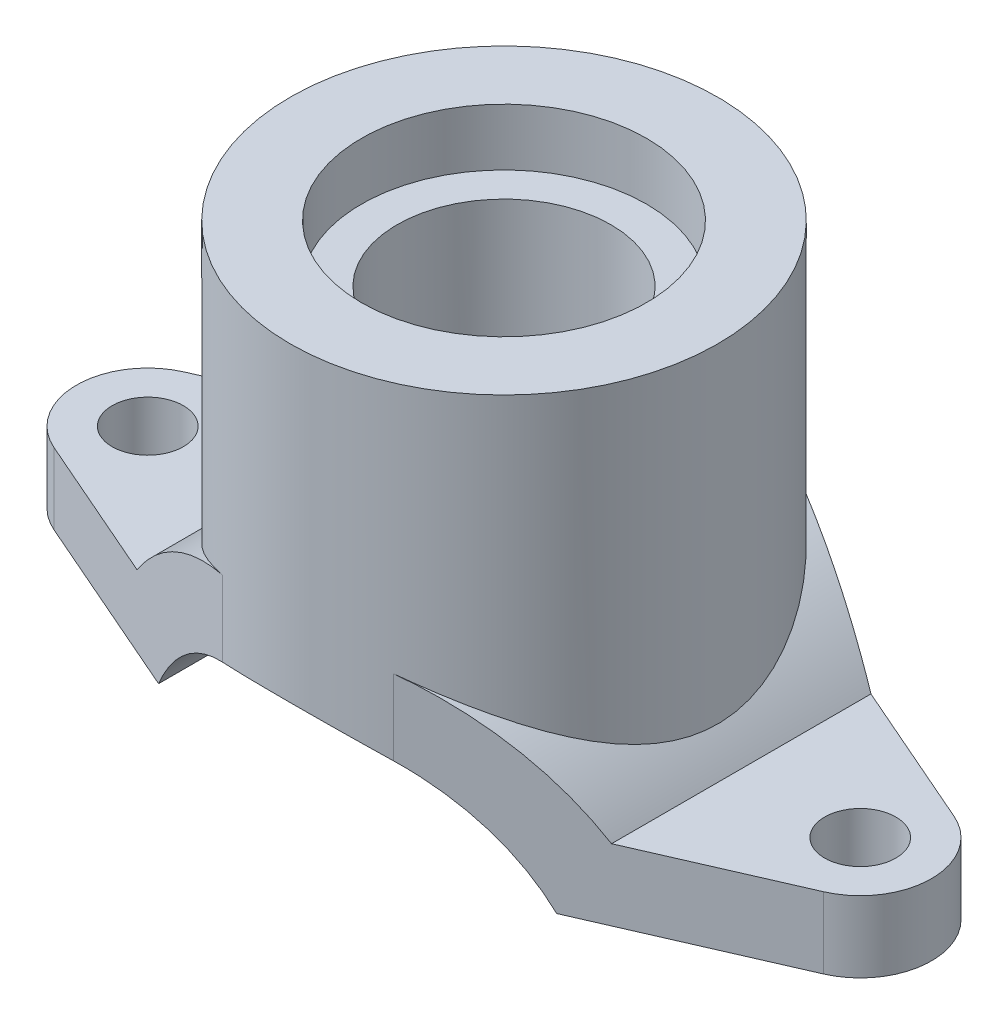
SolidWorks part; units mm, degrees
ref_plane "Front Plane" through (0, 0, 0) normal (0, 0, 1) x (1, 0, 0)
ref_plane "Top Plane" through (0, 0, 0) normal (0, 1, 0) x (1, 0, 0)
ref_plane "Right Plane" through (0, 0, 0) normal (1, 0, 0) x (0, 0, -1)
sketch "Sketch1" plane through (0, 0, 0) normal (0, 0, 1) x (1, 0, 0)
  line L0 (-69.8498, 0) -> (-150, 0)
  line L1 (-150, 0) -> (-150, 25)
  line L2 (-150, 25) -> (-83.2406, 25)
  line L3 (150, 25) -> (150, 0)
  line L4 (150, 0) -> (69.8498, 0)
  line L5 (83.2406, 25) -> (150, 25)
  arc A0 (69.8498, 0) -> (-69.8498, 0) centre (0, -39) ccw
  arc A1 (83.2406, 25) -> (-83.2406, 25) centre (0, -39) ccw
  dimension "D2" = 80
  dimension "D3" = 105
  dimension "D1" = 39
  dimension "D4" = 300
  dimension "D5" = 25
extrude "Extrude1" add sketch "Sketch1" along normal mid plane 150
ref_plane "Plane1" through (0, 66, 75) normal (0, 1, 0) x (-1, 0, 0)
sketch "Sketch2" plane through (0, 66, 75) normal (0, 1, 0) x (-1, 0, 0)
  line L0 (-135, -52.0871) -> (-30, -6.2614)
  line L1 (30, -6.2614) -> (135, -52.0871)
  line L2 (135, -97.9129) -> (30, -143.7386)
  line L3 (-135, -97.9129) -> (-30, -143.7386)
  line L4 (-150, 0) -> (-150, -150) construction
  arc A0 (-30, -143.7386) -> (30, -143.7386) centre (0, -75) ccw
  arc A1 (-135, -52.0871) -> (-135, -97.9129) centre (-125, -75) ccw
  arc A2 (135, -97.9129) -> (135, -52.0871) centre (125, -75) ccw
  arc A3 (30, -6.2614) -> (-30, -6.2614) centre (0, -75) ccw
  dimension "D2" = 25
  dimension "D3" = 75
  dimension "D1" = 250
extrude "Extrude2" cut sketch "Sketch2" against normal through all flip side to cut
ref_plane "Plane2" through (0, 150, 0) normal (0, 1, 0) x (-1, 0, 0)
sketch "Sketch3" plane through (0, 150, 0) normal (0, 1, 0) x (-1, 0, 0)
  circle A0 centre (0, 0) radius 75
  arc A1 (-30, -68.7386) -> (30, -68.7386) centre (0, 0) ccw construction
extrude "Extrude3" add sketch "Sketch3" against normal up to surface (84 mm away)
sketch "Sketch4" plane through (0, 0, 0) normal (0, 0, 1) x (1, 0, 0)
  line L0 (0, 0) -> (0, 168.5862) construction
  line L1 (0, 20) -> (0, 150)
  line L2 (0, 150) -> (50, 150)
  line L3 (75, 150) -> (-75, 150) construction
  line L4 (50, 150) -> (50, 130)
  line L5 (50, 130) -> (37.5, 130)
  line L6 (37.5, 130) -> (37.5, 20)
  line L7 (37.5, 20) -> (0, 20)
  dimension "D1" = 100
  dimension "D2" = 75
  dimension "D3" = 20
  dimension "D4" = 130
revolve "Cut-Revolve1" cut sketch "Sketch4" angle 360 about L0
sketch "Sketch5" plane through (0, 25, 0) normal (0, 1, 0) x (1, 0, 0)
  line L0 (0, 95.1634) -> (0, -88.8543) construction
  circle A0 centre (-125, 0) radius 12.5
  circle A1 centre (125, 0) radius 12.5
  arc A2 (-135, 22.9129) -> (-135, -22.9129) centre (-125, 0) ccw construction
  dimension "D1" = 25
extrude "Extrude4" cut sketch "Sketch5" against normal through all
